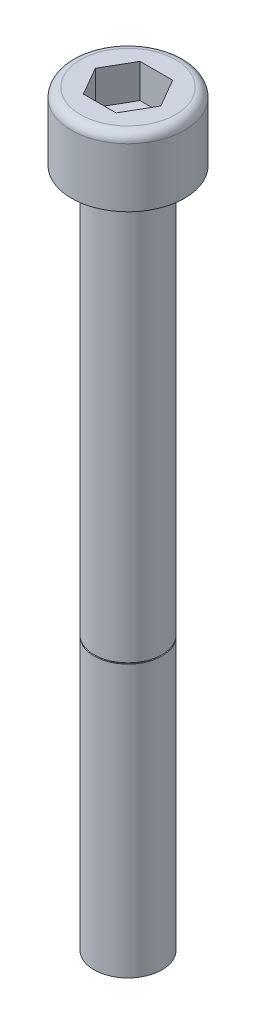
SolidWorks part; units mm, degrees
ref_plane "Aufriss" through (0, 0, 0) normal (0, 0, 1) x (1, 0, 0)
ref_plane "Grundriss" through (0, 0, 0) normal (0, 1, 0) x (1, 0, 0)
ref_plane "Seitenriss" through (0, 0, 0) normal (1, 0, 0) x (0, 0, -1)
sketch "Skizze1" plane through (0, 0, 0) normal (0, 0, 1) x (1, 0, 0)
  line L0 (0, 0) -> (-3, 0)
  line L1 (-3, 0) -> (-3, 24)
  line L2 (-3, 60) -> (-5, 60)
  line L3 (-5, 60) -> (-5, 65.2)
  line L4 (-4.2, 66) -> (0, 66)
  line L5 (0, 0) -> (0, 66) construction
  line L6 (0, 0) -> (0, 66)
  line L7 (-3, 24.1) -> (-3, 60)
  line L8 (-3, 24.1) -> (-2.9, 24.1)
  line L10 (-3, 24) -> (-2.9, 24)
  line L11 (-2.9, 24.1) -> (-2.9, 24)
  arc A0 (-5, 65.2) -> (-4.2, 66) centre (-4.2, 65.2) cw
  dimension "D1" = 6
  dimension "D5" = 0.8
  dimension "D2" = 10
  dimension "D3" = 60
  dimension "D4" = 6
  dimension "D6" = 0.1
  dimension "D7" = 0.1
  dimension "D8" = 24
revolve "Rotation1" add sketch "Skizze1" angle 360 about L5
sketch "Skizze2" plane through (0, 66, 0) normal (0, 1, 0) x (1, 0, 0)
  line L1 (1.4434, 2.5) -> (-1.4434, 2.5)
  line L2 (-1.4434, 2.5) -> (-2.8868, 0)
  line L3 (-2.8868, 0) -> (-1.4434, -2.5)
  line L4 (-1.4434, -2.5) -> (1.4434, -2.5)
  line L5 (1.4434, -2.5) -> (2.8868, 0)
  line L6 (2.8868, 0) -> (1.4434, 2.5)
  circle A0 centre (0, 0) radius 2.5 construction
  dimension "D1" = 5
extrude "Schnitt-Linear austragen1" cut sketch "Skizze2" against normal blind 3
